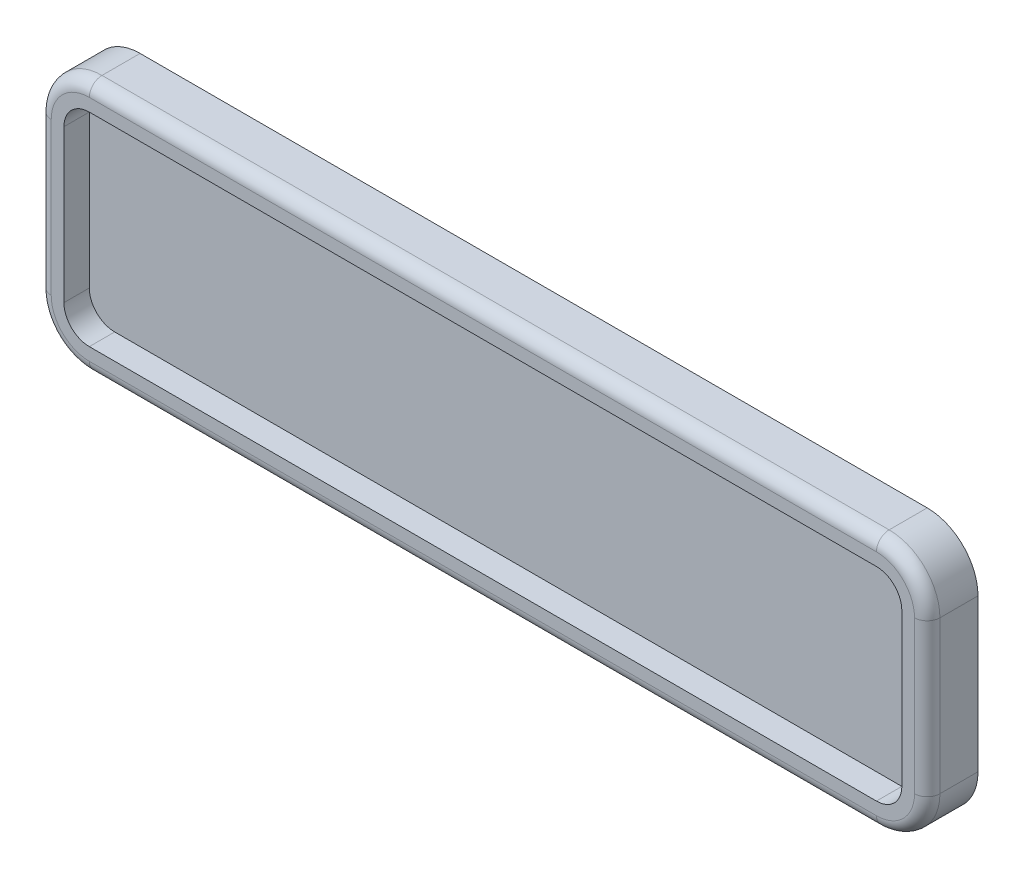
SolidWorks part; units mm, degrees
ref_plane "Front Plane" through (0, 0, 0) normal (0, 0, 1) x (1, 0, 0)
ref_plane "Top Plane" through (0, 0, 0) normal (0, 1, 0) x (1, 0, 0)
ref_plane "Right Plane" through (0, 0, 0) normal (1, 0, 0) x (0, 0, -1)
sketch "Sketch1" plane through (0, 0, 0) normal (0, 0, 1) x (1, 0, 0)
  line L1 (2, 0) -> (33, 0)
  line L2 (0, 2) -> (0, 8)
  line L3 (2, 10) -> (33, 10)
  line L4 (35, 2) -> (35, 8)
  arc A0 (33, 10) -> (35, 8) centre (33, 8) cw
  arc A1 (33, 0) -> (35, 2) centre (33, 2) ccw
  arc A2 (2, 0) -> (0, 2) centre (2, 2) cw
  arc A3 (0, 8) -> (2, 10) centre (2, 8) cw
  point P7 (35, 10)
  point P10 (35, 0)
  point P13 (0, 0)
  dimension "D3" = 2
  dimension "D1" = 35
  dimension "D2" = 10
extrude "Boss-Extrude1" add sketch "Sketch1" along normal blind 2
sketch "Sketch2" plane through (0, 0, 2) normal (0, 0, 1) x (1, 0, 0)
  line L0 (33, 9) -> (2, 9)
  line L1 (1, 8) -> (1, 2)
  line L2 (2, 1) -> (33, 1)
  line L3 (34, 2) -> (34, 8)
  line L4 (33, 10) -> (2, 10)
  line L5 (0, 8) -> (0, 2)
  line L6 (2, 0) -> (33, 0)
  line L7 (35, 2) -> (35, 8)
  line L16 (33, 10) -> (2, 10) construction
  line L17 (0, 8) -> (0, 2) construction
  line L18 (2, 0) -> (33, 0) construction
  line L19 (35, 2) -> (35, 8) construction
  arc A0 (2, 9) -> (1, 8) centre (2, 8) ccw
  arc A1 (1, 2) -> (2, 1) centre (2, 2) ccw
  arc A2 (33, 1) -> (34, 2) centre (33, 2) ccw
  arc A3 (34, 8) -> (33, 9) centre (33, 8) ccw
  arc A4 (35, 8) -> (33, 10) centre (33, 8) ccw
  arc A5 (2, 10) -> (0, 8) centre (2, 8) ccw
  arc A6 (0, 2) -> (2, 0) centre (2, 2) ccw
  arc A7 (33, 0) -> (35, 2) centre (33, 2) ccw
  arc A8 (35, 8) -> (33, 10) centre (33, 8) ccw construction
  arc A16 (2, 10) -> (0, 8) centre (2, 8) ccw construction
  arc A17 (0, 2) -> (2, 0) centre (2, 2) ccw construction
  arc A18 (33, 0) -> (35, 2) centre (33, 2) ccw construction
  dimension "D1" = 0
  dimension "D2" = 1
extrude "Cut-Extrude2" cut sketch "Sketch2" against normal blind 1
fillet "Fillet3" radius 0.5 8 edges at (34.4142, 0.5858, 2) (35, 5, 2) (34.4142, 9.4142, 2) (17.5, 0, 2) (0.5858, 0.5858, 2) (0, 5, 2) (0.5858, 9.4142, 2) (17.5, 10, 2)
